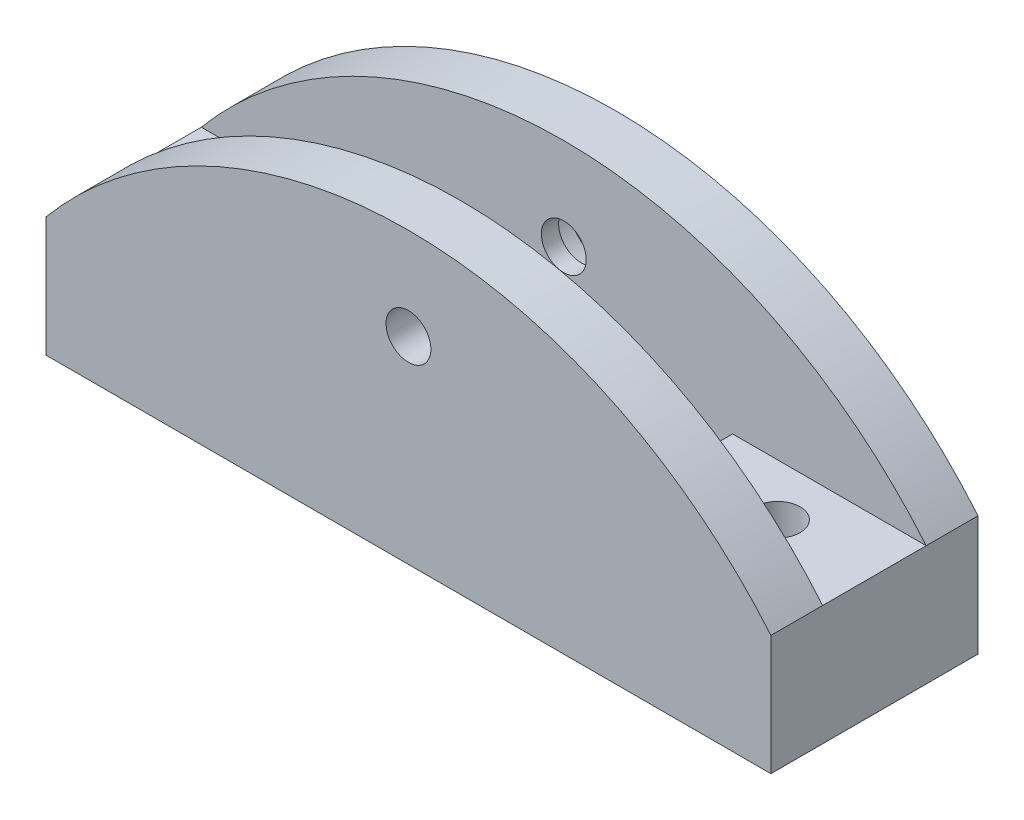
SolidWorks part; units mm, degrees
ref_plane "Front Plane" through (0, 0, 0) normal (0, 0, 1) x (1, 0, 0)
ref_plane "Top Plane" through (0, 0, 0) normal (0, 1, 0) x (1, 0, 0)
ref_plane "Right Plane" through (0, 0, 0) normal (1, 0, 0) x (0, 0, -1)
sketch "Sketch1" plane through (0, 0, 0) normal (0, 1, 0) x (1, 0, 0)
  line L1 (-21, -6) -> (21, -6)
  line L2 (-21, -6) -> (-21, 6)
  line L3 (-21, 6) -> (21, 6)
  line L4 (21, -6) -> (21, 6)
  line L5 (-21, -6) -> (21, 6) construction
  line L6 (-21, 6) -> (21, -6) construction
  point P0 (0, 0)
  dimension "D1" = 12
  dimension "D2" = 42
extrude "Boss-Extrude1" add sketch "Sketch1" along normal blind 6.94
sketch "Sketch2" plane through (0, 0, 6) normal (0, 0, 1) x (1, 0, 0)
  line L0 (-21, 6.94) -> (21, 6.94) construction
  line L1 (-21, 6.94) -> (-21, 0) construction
  line L2 (21, 6.94) -> (21, 0) construction
  circle A0 centre (0, 11.4403) radius 10.7703
  point P0 (-9.785, 6.94)
  point P1 (9.785, 6.94)
  point P8 (0, 0.67)
  dimension "D1" = 11.215
  dimension "D2" = 11.215
  dimension "D3" = 6.27
extrude "Cut-Extrude1" cut sketch "Sketch2" against normal through all contours A0
sketch "Sketch3" plane through (0, 0, 6) normal (0, 0, 1) x (1, 0, 0)
  line L1 (9.785, 6.94) -> (21, 6.94) construction
  line L2 (-21, 6.94) -> (-21, 0)
  line L3 (-21, 0) -> (21, 0)
  line L4 (21, 0) -> (21, 6.94)
  arc A0 (21, 6.94) -> (-21, 6.94) centre (0, -10.5763) ccw
  point P0 (0, 16.77)
  dimension "D1" = 9.83
extrude "Boss-Extrude2" add sketch "Sketch3" against normal blind 3
mirror "Mirror1" about plane through (0, 0, 0) normal (0, 0, 1) of "Boss-Extrude2"
sketch "Sketch4" plane through (0, 6.94, 0) normal (0, 1, 0) x (1, 0, 0)
  line L1 (-21, 3) -> (-9.785, -3) construction
  line L2 (9.785, -3) -> (21, 3) construction
  circle A0 centre (-15.3925, 0) radius 1.3
  circle A1 centre (15.3925, 0) radius 1.3
  point P3 (-15.3925, 0)
  dimension "D1" = 2.6
  dimension "D2" = 2.6
extrude "Cut-Extrude2" cut sketch "Sketch4" against normal through all
sketch "Sketch5" plane through (0, 0, 6) normal (0, 0, 1) x (1, 0, 0)
  circle A0 centre (0, 11.44) radius 1.3
  dimension "D2" = 2.6
  dimension "D1" = 4.5
extrude "Cut-Extrude3" cut sketch "Sketch5" against normal through all
sketch "Sketch6" plane through (0, 0, -6) normal (0, 0, -1) x (-1, 0, 0)
  circle A0 centre (0, 11.44) radius 3
  dimension "D1" = 6
extrude "Cut-Extrude4" cut sketch "Sketch6" against normal blind 2
